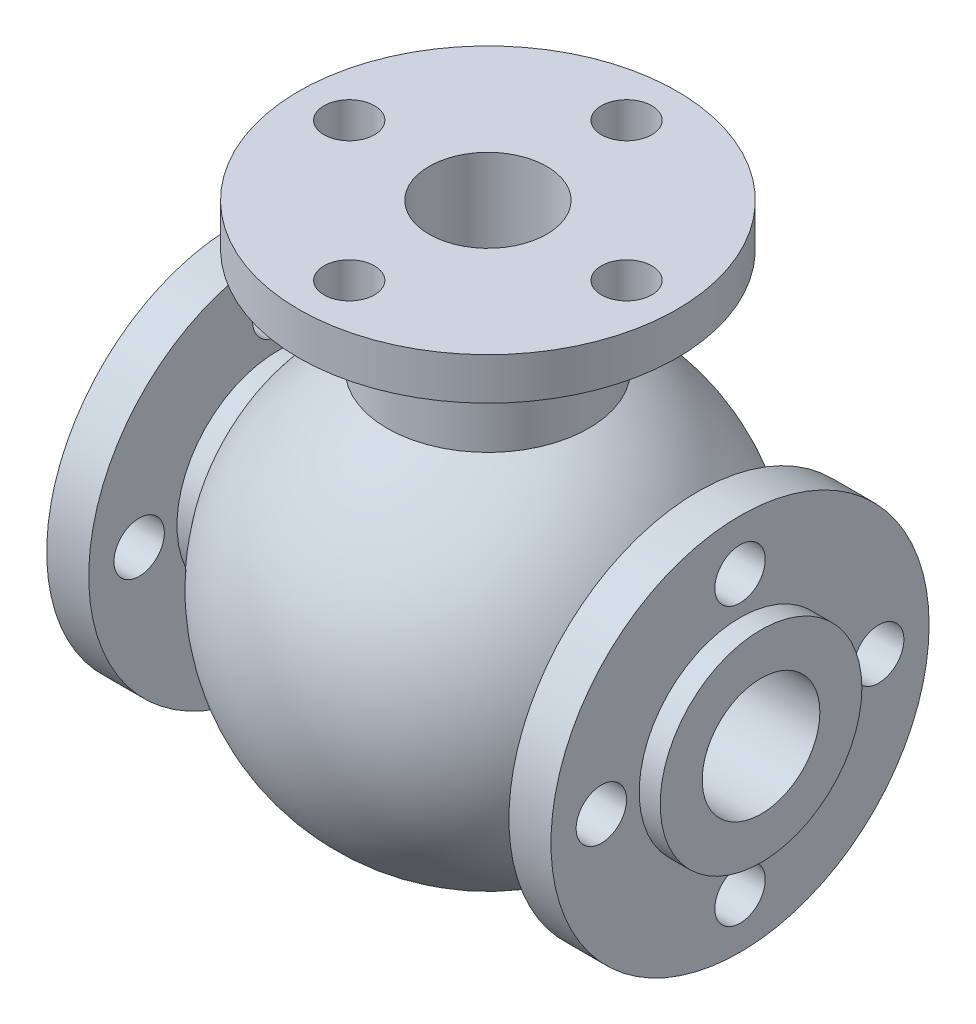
SolidWorks part; units mm, degrees
ref_plane "Front Plane" through (0, 0, 0) normal (0, 0, 1) x (1, 0, 0)
ref_plane "Top Plane" through (0, 0, 0) normal (0, 1, 0) x (1, 0, 0)
ref_plane "Right Plane" through (0, 0, 0) normal (1, 0, 0) x (0, 0, -1)
sketch "Sketch1" plane through (0, 0, 0) normal (0, 0, 1) x (1, 0, 0)
  line L0 (53.911, 0) -> (0, 0) construction
  line L1 (0, 0) -> (0, 61.8796) construction
  line L2 (38.5357, 14) -> (65, 14)
  line L3 (65, 14) -> (65, 24)
  line L4 (65, 24) -> (60, 24)
  line L5 (60, 24) -> (60, 45)
  line L6 (60, 45) -> (50, 45)
  line L7 (50, 45) -> (50, 24)
  line L8 (50, 24) -> (45, 24)
  line L9 (-38.5357, 14) -> (-65, 14)
  line L10 (-65, 14) -> (-65, 24)
  line L11 (-65, 24) -> (-60, 24)
  line L12 (-60, 24) -> (-60, 45)
  line L13 (-60, 45) -> (-50, 45)
  line L14 (-50, 45) -> (-50, 24)
  line L15 (-50, 24) -> (-45, 24)
  arc A0 (-38.5357, 14) -> (38.5357, 14) centre (0, 0) cw
  arc A1 (45, 24) -> (-45, 24) centre (0, 0) ccw
  dimension "D5" = 41
  dimension "D6" = 51
  dimension "D1" = 28
  dimension "D2" = 48
  dimension "D3" = 90
  dimension "D4" = 5
  dimension "D7" = 10
  dimension "D8" = 130
revolve "Revolve1" add sketch "Sketch1" angle 360 about L0
ref_plane "Plane1" through (0, 70, 0) normal (0, 1, 0) x (1, 0, 0)
sketch "Sketch2" plane through (0, 70, 0) normal (0, 1, 0) x (1, 0, 0)
  circle A0 centre (0, 0) radius 24
  dimension "D1" = 48
extrude "Boss-Extrude1" add sketch "Sketch2" against normal up to next
sketch "Sketch3" plane through (0, 70, 0) normal (0, 1, 0) x (1, 0, 0)
  circle A0 centre (0, 0) radius 45
  dimension "D1" = 90
extrude "Boss-Extrude2" add sketch "Sketch3" along normal blind 10
sketch "Sketch4" plane through (0, 80, 0) normal (0, 1, 0) x (1, 0, 0)
  circle A0 centre (0, 0) radius 14
  dimension "D1" = 28
extrude "Cut-Extrude1" cut sketch "Sketch4" against normal up to next
sketch "Sketch5" plane through (60, 0, 0) normal (1, 0, 0) x (0, 0, -1)
  circle A0 centre (0, 33) radius 6
  dimension "D1" = 12
  dimension "D2" = 33
extrude "Cut-Extrude2" cut sketch "Sketch5" against normal up to next
pattern_circular "CirPattern1" count 4 over 360 about axis through (0, 0, 0) along (1, 0, 0) of "Cut-Extrude2"
mirror "Mirror2" about plane through (0, 0, 0) normal (1, 0, 0) of "CirPattern1", "Cut-Extrude2"
sketch "Sketch6" plane through (0, 80, 0) normal (0, 1, 0) x (1, 0, 0)
  circle A0 centre (0, 33) radius 6
  dimension "D1" = 12
  dimension "D2" = 33
extrude "Cut-Extrude3" cut sketch "Sketch6" against normal up to next
pattern_circular "CirPattern2" count 4 over 360 about axis through (0, 0, 0) along (0, 1, 0) of "Cut-Extrude3"
